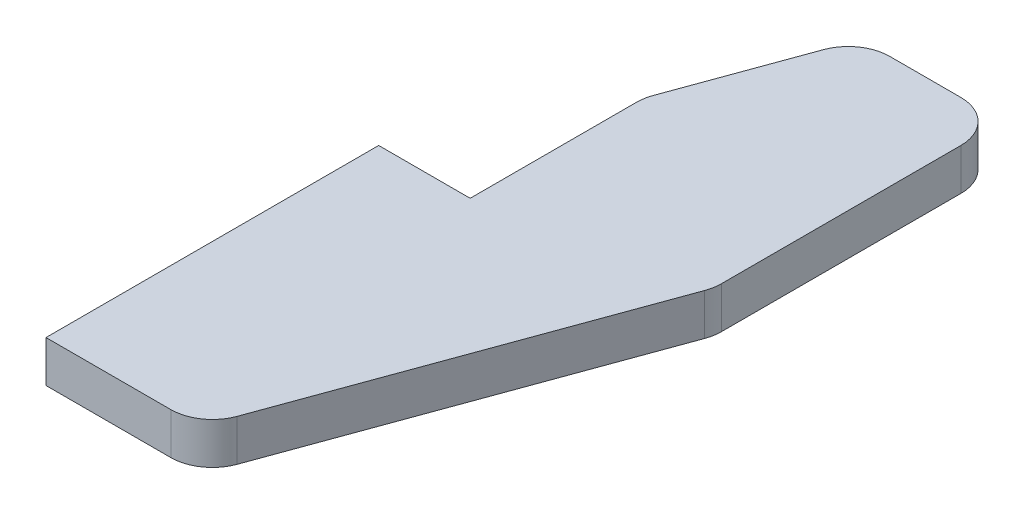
SolidWorks part; units mm, degrees
ref_plane "Plan de face" through (0, 0, 0) normal (0, 0, 1) x (1, 0, 0)
ref_plane "Plan de dessus" through (0, 0, 0) normal (0, 1, 0) x (1, 0, 0)
ref_plane "Plan de droite" through (0, 0, 0) normal (1, 0, 0) x (0, 0, -1)
ref_plane "Plan1" through (0, 2.5, 0) normal (0, 1, 0) x (1, 0, 0)
sketch "Esquisse1" plane through (0, 2.5, 0) normal (0, 1, 0) x (1, 0, 0)
  line L0 (11, 0) -> (0, 0)
  line L1 (0, 0) -> (0, -40)
  line L2 (0, -40) -> (15, -40)
  line L3 (19.6985, -36.7101) -> (34.6985, 4.5021)
  line L4 (35, 6.2122) -> (35, 35)
  line L5 (30, 40) -> (21.4596, 40)
  line L6 (16.7611, 36.7101) -> (11.3015, 21.7101)
  line L7 (11, 20) -> (11, 0)
  arc A0 (15, -40) -> (19.6985, -36.7101) centre (15, -35) ccw
  arc A1 (34.6985, 4.5021) -> (35, 6.2122) centre (30, 6.2122) ccw
  arc A2 (35, 35) -> (30, 40) centre (30, 35) ccw
  arc A3 (21.4596, 40) -> (16.7611, 36.7101) centre (21.4596, 35) ccw
  arc A4 (11.3015, 21.7101) -> (11, 20) centre (16, 20) ccw
extrude "Boss.-Extru.1" add sketch "Esquisse1" against normal blind 5
